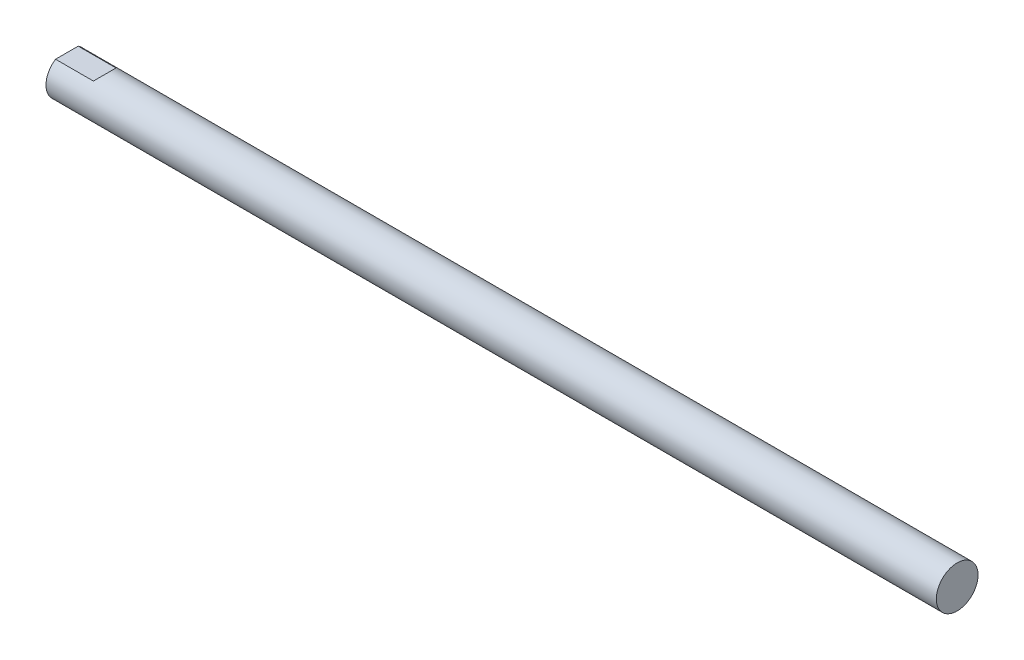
SolidWorks part; units mm, degrees
ref_plane "Front Plane" through (0, 0, 0) normal (0, 0, 1) x (1, 0, 0)
ref_plane "Top Plane" through (0, 0, 0) normal (0, 1, 0) x (1, 0, 0)
ref_plane "Right Plane" through (0, 0, 0) normal (1, 0, 0) x (0, 0, -1)
sketch "Sketch1" plane through (0, 0, 0) normal (0, 0, 1) x (1, 0, 0)
  line L0 (0, 0) -> (0, 9.525)
  line L1 (0, 9.525) -> (406.4, 9.525)
  line L2 (406.4, 9.525) -> (406.4, 0)
  line L3 (406.4, 0) -> (0, 0)
  line L4 (-29.8622, 0) -> (246.4486, 0) construction
  dimension "D1" = 19.05
  dimension "D2" = 406.4
revolve "Revolve1" add sketch "Sketch1" angle 360 about L4
hole_wizard "3/8-16 Tapped Hole1" positions "Sketch3" profile "Sketch2" tap size "3/8-16" standard "ANSI Inch"
sketch "Sketch3" plane through (0, 0, 0) normal (-1, 0, 0) x (0, 0, 1)
  point P0 (0, 0)
sketch "Sketch2" plane through (0, 0, 0) normal (0, 1, 0) x (0, 0, 1)
  line L0 (0, 0) -> (0, 29.3849)
  line L1 (0, 29.3849) -> (3.9687, 27.0002)
  line L2 (3.9687, 27.0002) -> (3.9687, 0)
  line L5 (3.9687, 0) -> (0, 0)
  line L10 (0, 29.3849) -> (-3.9688, 27.0002) construction
  line L11 (0, -6.35) -> (0, 107.95) construction
  dimension "Tap Drill Dia." = 7.9375
  dimension "Tap Drill Depth" = 27.0002
  dimension "Drill Angle" = 118
sketch "Sketch4" plane through (0, 0, 0) normal (0, 0, 1) x (1, 0, 0)
  line L0 (0, 8.001) -> (17.272, 8.001)
  line L1 (0, 9.525) -> (0, -9.525) construction
  line L2 (17.272, 8.001) -> (18.796, 9.525)
  line L3 (406.4, 9.525) -> (0, 9.525) construction
  line L4 (18.796, 9.525) -> (0, 9.525)
  line L5 (0, 9.525) -> (0, 8.001)
  line L6 (-5.7422, 0) -> (50.3718, 0) construction
  line L7 (0, -9.525) -> (406.4, -9.525) construction
  dimension "D1" = 17.526
  dimension "D2" = 45
  dimension "D3" = 17.272
extrude "Cut-Extrude1" cut sketch "Sketch4" against normal through all both and the other way through all
